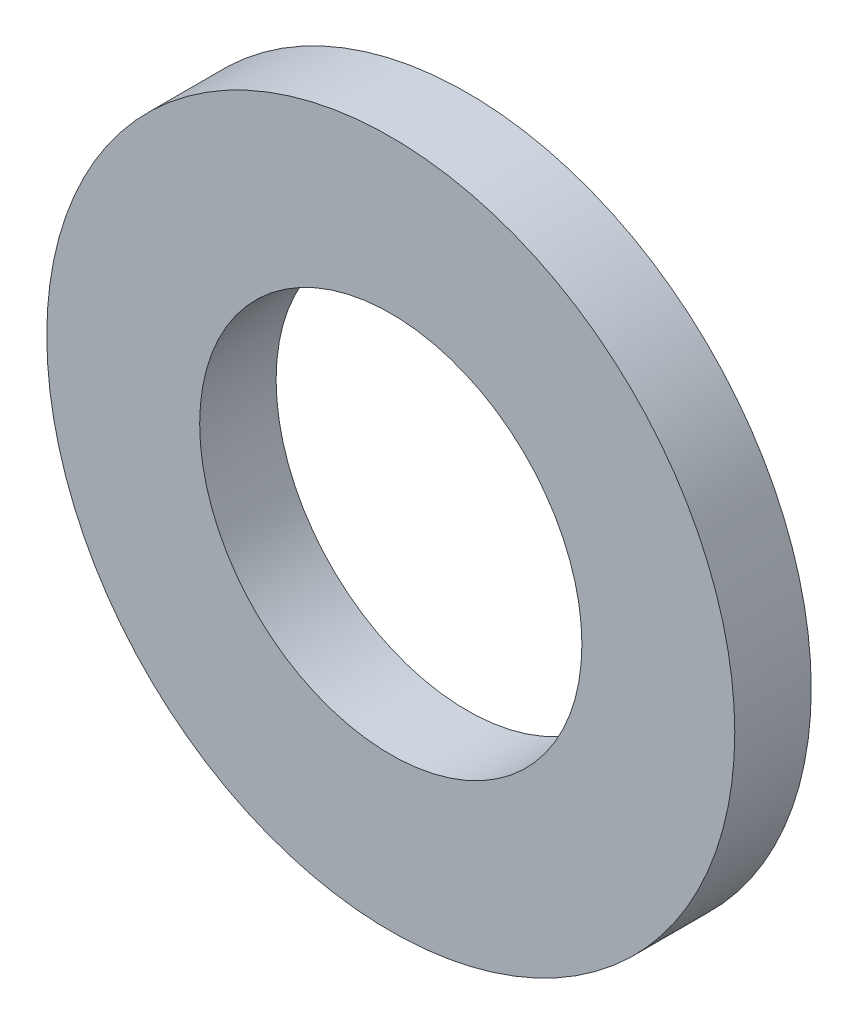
SolidWorks part; units mm, degrees
ref_plane "Face" through (0, 0, 0) normal (0, 0, 1) x (1, 0, 0)
ref_plane "Dessus" through (0, 0, 0) normal (0, 1, 0) x (1, 0, 0)
ref_plane "Droite" through (0, 0, 0) normal (1, 0, 0) x (0, 0, -1)
sketch "Esquisse1" plane through (0, 0, 0) normal (0, 0, 1) x (1, 0, 0)
  circle A0 centre (0, 0) radius 9
  circle A1 centre (0, 0) radius 5
  dimension "D1" = 18
  dimension "D2" = 10
extrude "Extrusion1" add sketch "Esquisse1" along normal blind 2
